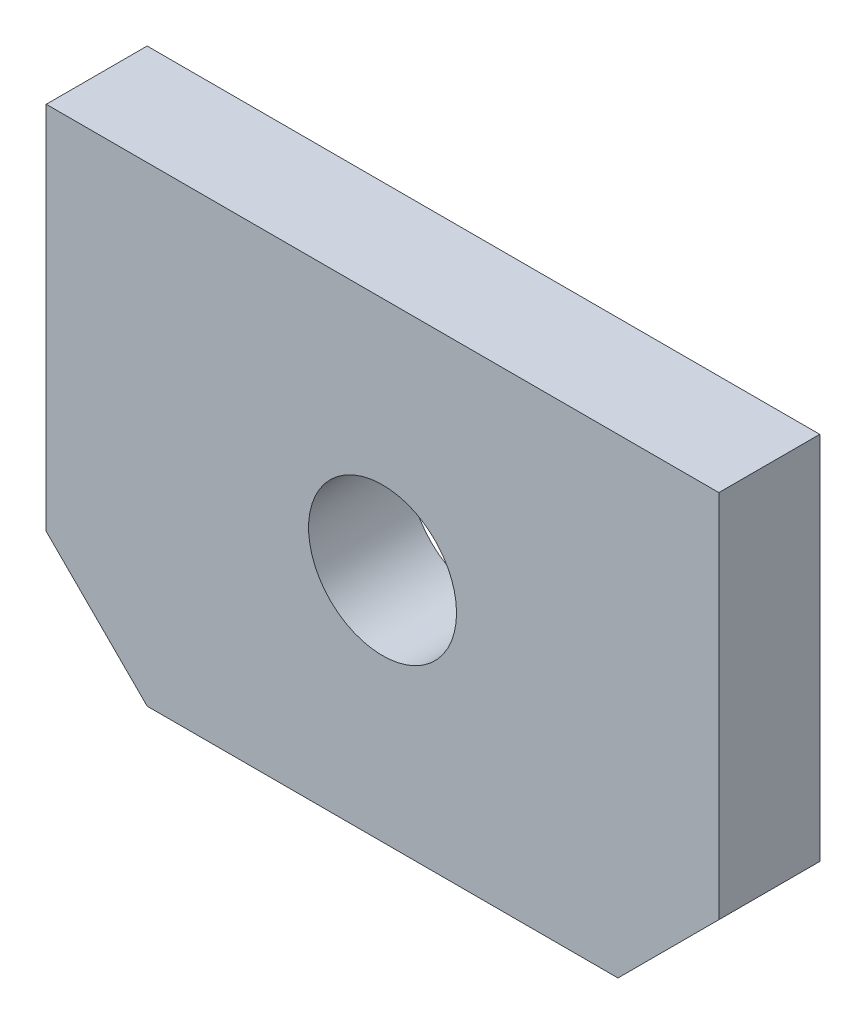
SolidWorks part; units mm, degrees
ref_plane "Face" through (0, 0, 0) normal (0, 0, 1) x (1, 0, 0)
ref_plane "Dessus" through (0, 0, 0) normal (0, 1, 0) x (1, 0, 0)
ref_plane "Droite" through (0, 0, 0) normal (1, 0, 0) x (0, 0, -1)
sketch "Esquisse2" plane through (0, 0, 0) normal (0, 0, 1) x (1, 0, 0)
  line L0 (-20.4509, -8.0054) -> (-18.9509, -9.5054)
  line L1 (-20.4509, -2.5054) -> (-10.4509, -2.5054)
  line L2 (-20.4509, -2.5054) -> (-20.4509, -8.0054)
  line L3 (-18.9509, -9.5054) -> (-11.9509, -9.5054)
  line L4 (-10.4509, -2.5054) -> (-10.4509, -8.0054)
  line L5 (-10.4509, -8.0054) -> (-11.9509, -9.5054)
  circle A0 centre (-15.4509, -6.0054) radius 1.1
  point P1 (-10.4509, -9.5054)
  point P2 (-20.4509, -9.5054)
  dimension "D3" = 5
  dimension "D1" = 10
  dimension "D2" = 7
  dimension "D5" = 1.5
  dimension "D6" = 1.5
  dimension "D4" = 3.5
extrude "Extrusion1" add sketch "Esquisse2" along normal blind 1.5
